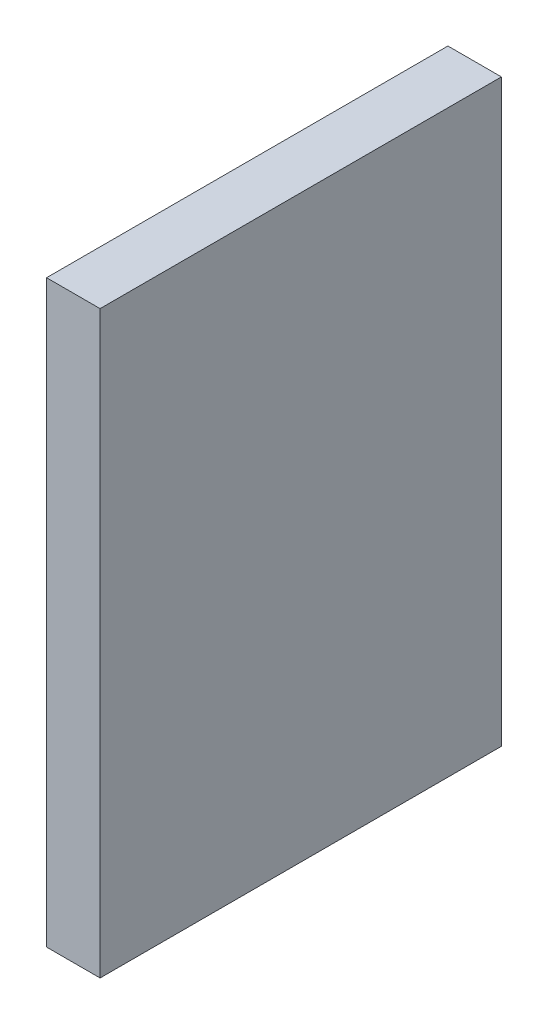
SolidWorks part; units mm, degrees
ref_plane "Plan de face" through (0, 0, 0) normal (0, 0, 1) x (1, 0, 0)
ref_plane "Plan de dessus" through (0, 0, 0) normal (0, 1, 0) x (1, 0, 0)
ref_plane "Plan de droite" through (0, 0, 0) normal (1, 0, 0) x (0, 0, -1)
sketch "Esquisse1" plane through (0, 0, 0) normal (0, 0, 1) x (1, 0, 0)
  line L1 (0, 0) -> (12, 0)
  line L2 (0, 0) -> (0, 130)
  line L3 (0, 130) -> (12, 130)
  line L4 (12, 0) -> (12, 130)
  dimension "D1" = 12
  dimension "D2" = 130
extrude "Extrusion1" add sketch "Esquisse1" along normal blind 90
